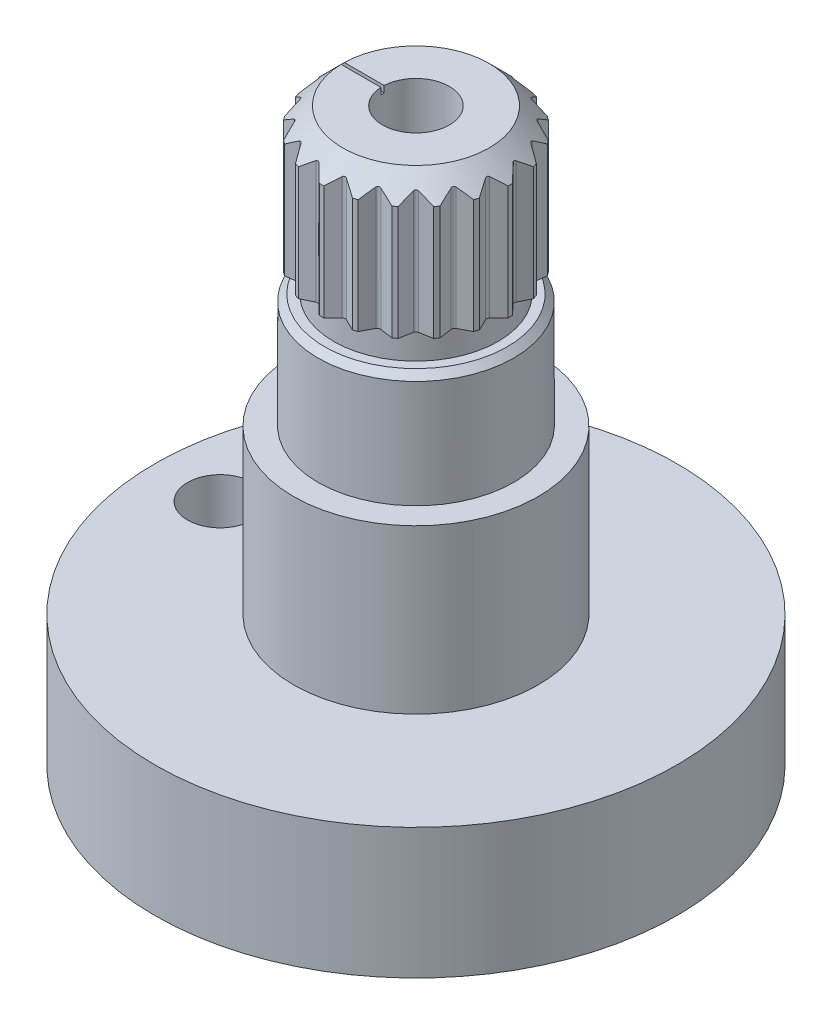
SolidWorks part; units mm, degrees
ref_plane "Face" through (0, 0, 0) normal (0, 0, 1) x (1, 0, 0)
ref_plane "Dessus" through (0, 0, 0) normal (0, 1, 0) x (1, 0, 0)
ref_plane "Droite" through (0, 0, 0) normal (1, 0, 0) x (0, 0, -1)
imported_body "Importée1"
sketch "Esquisse1" plane through (0, 3.85, 0) normal (0, 1, 0) x (-1, 0, 0)
  line L2 (2.394, -0.05) -> (1.0238, -0.05)
  line L3 (1.0238, 0.05) -> (2.394, 0.05)
  line L4 (2.394, -0.05) -> (1.0238, -0.05)
  line L5 (1.0238, 0.05) -> (2.394, 0.05)
  arc A2 (1.0238, 0.05) -> (1.0238, -0.05) centre (0, 0) ccw
  arc A3 (2.394, 0.05) -> (2.394, -0.05) centre (0, 0) ccw
  arc A4 (1.0238, 0.05) -> (1.0238, -0.05) centre (0, 0) ccw
  arc A5 (2.394, 0.05) -> (2.394, -0.05) centre (0, 0) ccw
  dimension "D1" = 0
extrude "Extrusion1" add sketch "Esquisse1" along normal blind 0.15
sketch "Esquisse3" plane through (0, 0, 0) normal (1, 0, 0) x (0, 0, -1)
  line L0 (2.8937, 3.3508) -> (2.3945, 3.85) construction
  line L1 (3.2602, 2.9843) -> (1.8656, 4.3789)
  line L2 (1.8656, 4.3789) -> (3.2602, 4.3789)
  line L3 (3.2602, 4.3789) -> (3.2602, 2.9843)
  line L4 (0, 0) -> (0, 4.3789) construction
revolve "Enlèvement de matière-Révolution1" cut sketch "Esquisse3" angle 360 about L4
